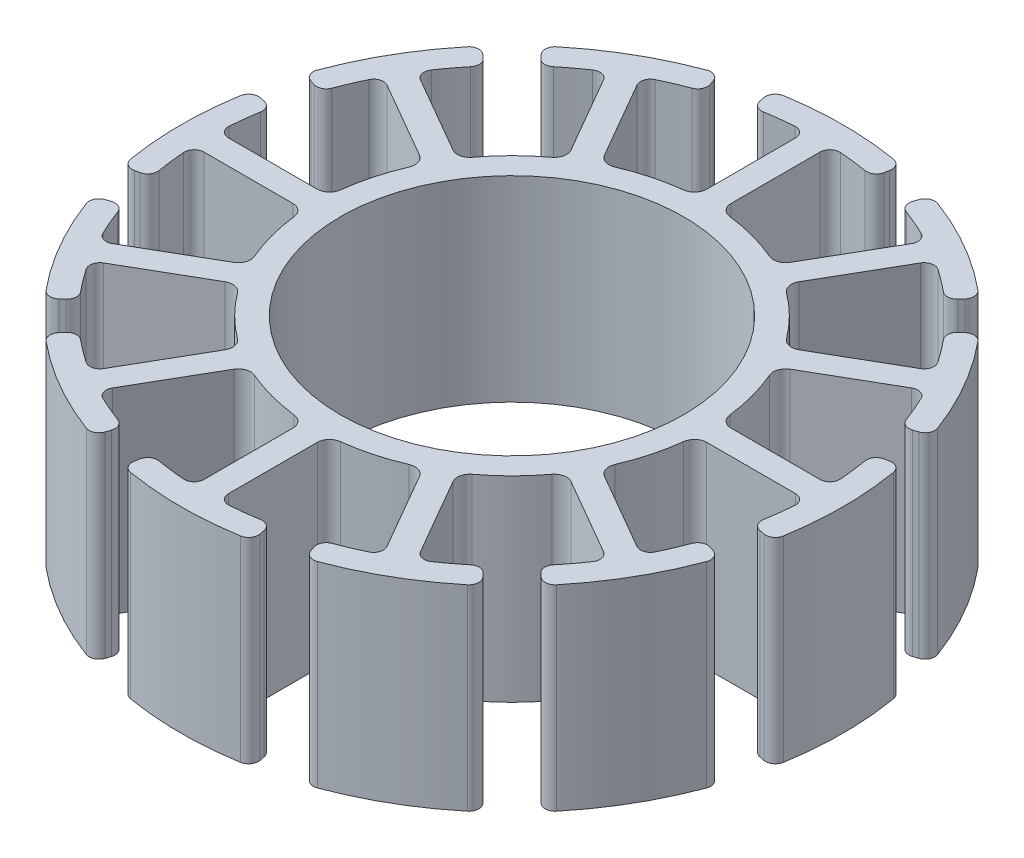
SolidWorks part; units mm, degrees
ref_plane "Front Plane" through (0, 0, 0) normal (0, 0, 1) x (1, 0, 0)
ref_plane "Top Plane" through (0, 0, 0) normal (0, 1, 0) x (1, 0, 0)
ref_plane "Right Plane" through (0, 0, 0) normal (1, 0, 0) x (0, 0, -1)
sketch "Sketch1" plane through (0, 0, 0) normal (0, 1, 0) x (1, 0, 0)
  circle A0 centre (0, 0) radius 7
  circle A1 centre (0, 0) radius 8
  dimension "D1" = 14
  dimension "D2" = 1
extrude "Boss-Extrude1" add sketch "Sketch1" along normal blind 8 contours A1 | A0
sketch "Sketch2" plane through (0, 8, 0) normal (0, 1, 0) x (1, 0, 0)
  line L0 (0, -8) -> (0, -13.5) construction
  line L1 (0.5, -7.717) -> (0.5, -12.0665)
  line L2 (-0.5, -7.717) -> (-0.5, -12.0665)
  line L3 (-2.5, -12.5) -> (2.5, -12.5) construction
  line L4 (2.5287, -12.6434) -> (2.5679, -12.8396)
  line L5 (-2.5287, -12.6434) -> (-2.5679, -12.8396)
  line L6 (0, -8) -> (0, -7.717) construction
  line L7 (-0.5, -7.717) -> (0.5, -7.717)
  arc A0 (-2.2421, -13.3125) -> (2.2421, -13.3125) centre (0, 0) ccw
  arc A1 (0.9298, -12.4654) -> (2.0702, -12.3274) centre (0, 0) ccw
  circle A2 centre (0, 0) radius 8 construction
  arc A3 (-2.0702, -12.3274) -> (-0.9298, -12.4654) centre (0, 0) ccw
  arc A4 (2.5679, -12.8396) -> (2.2421, -13.3125) centre (2.1757, -12.9181) cw
  arc A5 (2.5287, -12.6434) -> (2.0702, -12.3274) centre (2.1364, -12.7219) ccw
  arc A6 (-2.5679, -12.8396) -> (-2.2421, -13.3125) centre (-2.1757, -12.9181) ccw
  arc A7 (-2.5287, -12.6434) -> (-2.0702, -12.3274) centre (-2.1364, -12.7219) cw
  arc A8 (0.5, -12.0665) -> (0.9298, -12.4654) centre (0.9, -12.0665) ccw
  arc A9 (-0.5, -12.0665) -> (-0.9298, -12.4654) centre (-0.9, -12.0665) cw
  point P14 (0, -12.5)
  point P25 (-2.4515, -12.2573)
  dimension "D1" = 27
  dimension "D2" = 1
  dimension "D6" = 0.4
  dimension "D7" = 0.4
  dimension "D3" = 0.5
  dimension "D4" = 0.5
  dimension "D5" = 5
extrude "Boss-Extrude2" add sketch "Sketch2" against normal up to surface (8 mm away)
pattern_circular "CirPattern1" count 12 over 360 about axis through (0, 0, 0) along (0, 1, 0) of "Boss-Extrude2"
fillet "Fillet1" radius 0.5 24 edges at (-7.9844, 4, 0.5) (-3.5592, 4, -7.1647) (-7.1647, 4, -3.5592) (4.4252, 4, 6.6647) (7.1647, 4, 3.5592) (7.1647, 4, -3.5592) (0.5, 4, -7.9844) (6.6647, 4, -4.4252) (4.4252, 4, -6.6647) (7.9844, 4, -0.5) (3.5592, 4, -7.1647) (-0.5, 4, -7.9844) (-4.4252, 4, -6.6647) (-6.6647, 4, -4.4252) (-7.9844, 4, -0.5) (-4.4252, 4, 6.6647) (-7.1647, 4, 3.5592) (7.9844, 4, 0.5) (6.6647, 4, 4.4252) (3.5592, 4, 7.1647) (-6.6647, 4, 4.4252) (-3.5592, 4, 7.1647) (-0.5, 4, 7.9844) (0.5, 4, 7.9844)
